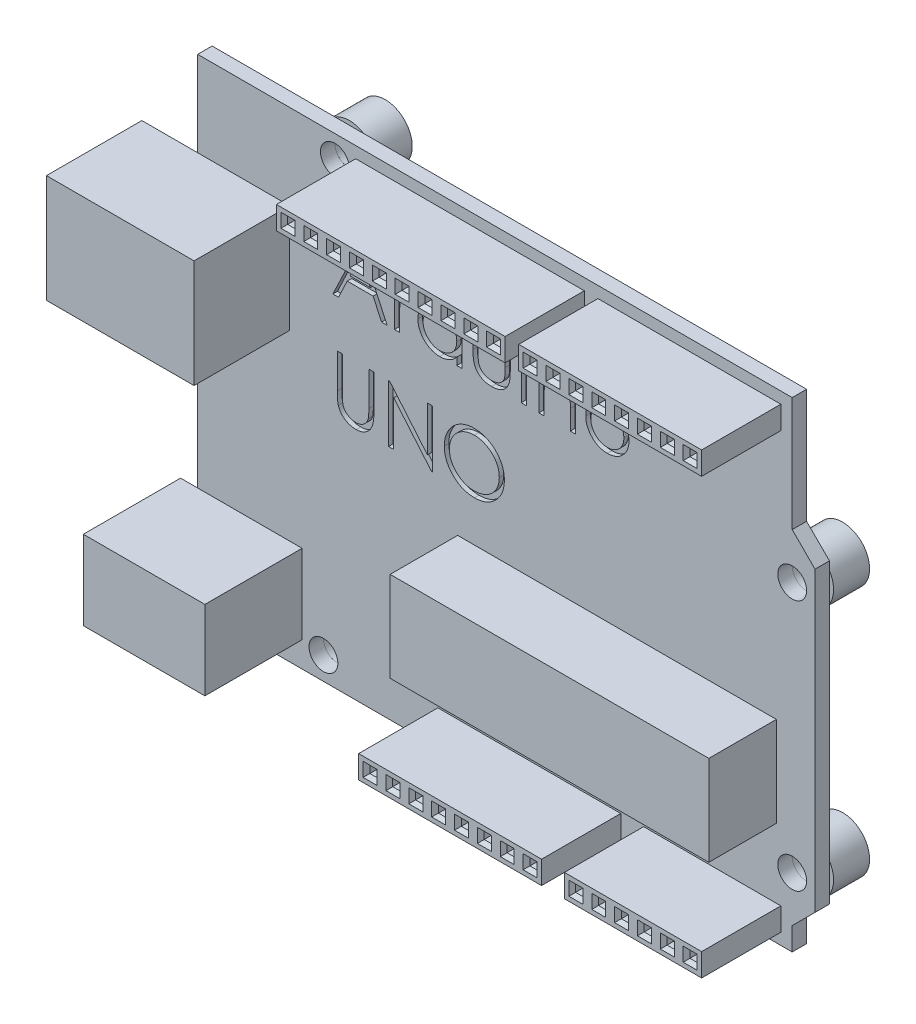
SolidWorks part; units mm, degrees
ref_plane "Front" through (0, 0, 0) normal (0, 0, 1) x (1, 0, 0)
ref_plane "Top" through (0, 0, 0) normal (0, 1, 0) x (1, 0, 0)
ref_plane "Right" through (0, 0, 0) normal (1, 0, 0) x (0, 0, -1)
sketch "Esquisse2" plane through (0, 0, 0) normal (0, 0, 1) x (1, 0, 0)
  line L0 (0, 0) -> (66.04, 0)
  line L1 (66.04, 0) -> (66.04, 2.54)
  line L2 (66.04, 2.54) -> (68.58, 5.08)
  line L3 (68.58, 5.08) -> (68.58, 38.1)
  line L4 (68.58, 38.1) -> (66.04, 40.64)
  line L5 (66.04, 40.64) -> (66.04, 53.34)
  line L6 (66.04, 53.34) -> (0, 53.34)
  line L7 (0, 53.34) -> (0, 0)
  circle A0 centre (15.24, 50.8) radius 1.6
  circle A1 centre (13.97, 2.54) radius 1.6
  circle A2 centre (66.04, 7.62) radius 1.6
  circle A3 centre (66.04, 35.56) radius 1.6
  dimension "D7" = 3.2
  dimension "D9" = 2.54
  dimension "D10" = 15.24
  dimension "D12" = 5.08
  dimension "D13" = 15.24
  dimension "D3" = 50.8
  dimension "D8" = 27.94
  dimension "D1" = 53.34
  dimension "D2" = 68.58
  dimension "D4" = 2.54
  dimension "D5" = 33.02
  dimension "D6" = 2.54
  dimension "D11" = 13.97
extrude "Boss.-Extru.1" add sketch "Esquisse2" along normal blind 1.6
sketch "Esquisse3" plane through (0, 0, 1.6) normal (0, 0, 1) x (1, 0, 0)
  line L0 (17.55, 50.8) -> (64.78, 50.8) construction
  line L1 (17.55, 52.07) -> (64.78, 52.07)
  line L2 (17.55, 52.07) -> (17.55, 49.53)
  line L3 (17.55, 49.53) -> (64.78, 49.53)
  line L4 (64.78, 52.07) -> (64.78, 49.53)
  line L5 (66.04, 53.34) -> (0, 53.34) construction
  line L6 (0, 53.34) -> (0, 0) construction
  line L7 (63.11, 51.2) -> (63.91, 51.2)
  line L8 (63.11, 51.2) -> (63.11, 50.4)
  line L9 (63.11, 50.4) -> (63.91, 50.4)
  line L10 (63.91, 51.2) -> (63.91, 50.4)
  line L11 (63.11, 51.2) -> (63.91, 50.4) construction
  line L12 (63.11, 50.4) -> (63.91, 51.2) construction
  line L13 (60.57, 51.2) -> (61.37, 51.2)
  line L14 (60.57, 51.2) -> (60.57, 50.4)
  line L15 (60.57, 50.4) -> (61.37, 50.4)
  line L16 (61.37, 51.2) -> (61.37, 50.4)
  line L17 (58.03, 51.2) -> (58.83, 51.2)
  line L18 (58.03, 51.2) -> (58.03, 50.4)
  line L19 (58.03, 50.4) -> (58.83, 50.4)
  line L20 (58.83, 51.2) -> (58.83, 50.4)
  line L21 (55.49, 51.2) -> (56.29, 51.2)
  line L22 (55.49, 51.2) -> (55.49, 50.4)
  line L23 (55.49, 50.4) -> (56.29, 50.4)
  line L24 (56.29, 51.2) -> (56.29, 50.4)
  line L25 (52.95, 51.2) -> (53.75, 51.2)
  line L26 (52.95, 51.2) -> (52.95, 50.4)
  line L27 (52.95, 50.4) -> (53.75, 50.4)
  line L28 (53.75, 51.2) -> (53.75, 50.4)
  line L29 (50.41, 51.2) -> (51.21, 51.2)
  line L30 (50.41, 51.2) -> (50.41, 50.4)
  line L31 (50.41, 50.4) -> (51.21, 50.4)
  line L32 (51.21, 51.2) -> (51.21, 50.4)
  line L33 (47.87, 51.2) -> (48.67, 51.2)
  line L34 (47.87, 51.2) -> (47.87, 50.4)
  line L35 (47.87, 50.4) -> (48.67, 50.4)
  line L36 (48.67, 51.2) -> (48.67, 50.4)
  line L37 (45.33, 51.2) -> (46.13, 51.2)
  line L38 (45.33, 51.2) -> (45.33, 50.4)
  line L39 (45.33, 50.4) -> (46.13, 50.4)
  line L40 (46.13, 51.2) -> (46.13, 50.4)
  line L41 (63.11, 51.2) -> (60.57, 51.2) construction
  line L42 (41.28, 51.2) -> (42.08, 51.2)
  line L43 (41.28, 51.2) -> (41.28, 50.4)
  line L44 (41.28, 50.4) -> (42.08, 50.4)
  line L45 (42.08, 51.2) -> (42.08, 50.4)
  line L46 (45.33, 51.2) -> (41.28, 51.2) construction
  line L47 (38.74, 51.2) -> (39.54, 51.2)
  line L48 (38.74, 51.2) -> (38.74, 50.4)
  line L49 (38.74, 50.4) -> (39.54, 50.4)
  line L50 (39.54, 51.2) -> (39.54, 50.4)
  line L51 (36.2, 51.2) -> (37, 51.2)
  line L52 (36.2, 51.2) -> (36.2, 50.4)
  line L53 (36.2, 50.4) -> (37, 50.4)
  line L54 (37, 51.2) -> (37, 50.4)
  line L55 (33.66, 51.2) -> (34.46, 51.2)
  line L56 (33.66, 51.2) -> (33.66, 50.4)
  line L57 (33.66, 50.4) -> (34.46, 50.4)
  line L58 (34.46, 51.2) -> (34.46, 50.4)
  line L59 (31.12, 51.2) -> (31.92, 51.2)
  line L60 (31.12, 51.2) -> (31.12, 50.4)
  line L61 (31.12, 50.4) -> (31.92, 50.4)
  line L62 (31.92, 51.2) -> (31.92, 50.4)
  line L63 (28.58, 51.2) -> (29.38, 51.2)
  line L64 (28.58, 51.2) -> (28.58, 50.4)
  line L65 (28.58, 50.4) -> (29.38, 50.4)
  line L66 (29.38, 51.2) -> (29.38, 50.4)
  line L67 (26.04, 51.2) -> (26.84, 51.2)
  line L68 (26.04, 51.2) -> (26.04, 50.4)
  line L69 (26.04, 50.4) -> (26.84, 50.4)
  line L70 (26.84, 51.2) -> (26.84, 50.4)
  line L71 (23.5, 51.2) -> (24.3, 51.2)
  line L72 (23.5, 51.2) -> (23.5, 50.4)
  line L73 (23.5, 50.4) -> (24.3, 50.4)
  line L74 (24.3, 51.2) -> (24.3, 50.4)
  line L75 (20.96, 51.2) -> (21.76, 51.2)
  line L76 (20.96, 51.2) -> (20.96, 50.4)
  line L77 (20.96, 50.4) -> (21.76, 50.4)
  line L78 (21.76, 51.2) -> (21.76, 50.4)
  line L79 (18.42, 51.2) -> (19.22, 51.2)
  line L80 (18.42, 51.2) -> (18.42, 50.4)
  line L81 (18.42, 50.4) -> (19.22, 50.4)
  line L82 (19.22, 51.2) -> (19.22, 50.4)
  line L83 (41.28, 51.2) -> (38.74, 51.2) construction
  line L84 (18.82, 51.2) -> (18.82, 50.4) construction
  line L85 (26.68, 2.54) -> (64.78, 2.54) construction
  line L86 (26.68, 3.81) -> (64.78, 3.81)
  line L87 (26.68, 3.81) -> (26.68, 1.27)
  line L88 (26.68, 1.27) -> (64.78, 1.27)
  line L89 (64.78, 3.81) -> (64.78, 1.27)
  line L90 (0, 0) -> (66.04, 0) construction
  line L91 (30.09, 2.94) -> (30.89, 2.94)
  line L92 (27.55, 2.94) -> (28.35, 2.94)
  line L93 (27.55, 2.94) -> (27.55, 2.14)
  line L94 (27.55, 2.14) -> (28.35, 2.14)
  line L95 (28.35, 2.94) -> (28.35, 2.14)
  line L96 (27.55, 2.94) -> (28.35, 2.14) construction
  line L97 (27.55, 2.14) -> (28.35, 2.94) construction
  line L98 (30.09, 2.94) -> (30.09, 2.14)
  line L99 (30.09, 2.14) -> (30.89, 2.14)
  line L100 (30.89, 2.94) -> (30.89, 2.14)
  line L101 (30.09, 2.94) -> (30.89, 2.14) construction
  line L102 (30.09, 2.14) -> (30.89, 2.94) construction
  line L103 (32.63, 2.94) -> (33.43, 2.94)
  line L104 (32.63, 2.94) -> (32.63, 2.14)
  line L105 (32.63, 2.14) -> (33.43, 2.14)
  line L106 (33.43, 2.94) -> (33.43, 2.14)
  line L107 (32.63, 2.94) -> (33.43, 2.14) construction
  line L108 (32.63, 2.14) -> (33.43, 2.94) construction
  line L109 (35.17, 2.94) -> (35.97, 2.94)
  line L110 (35.17, 2.94) -> (35.17, 2.14)
  line L111 (35.17, 2.14) -> (35.97, 2.14)
  line L112 (35.97, 2.94) -> (35.97, 2.14)
  line L113 (35.17, 2.94) -> (35.97, 2.14) construction
  line L114 (35.17, 2.14) -> (35.97, 2.94) construction
  line L115 (37.71, 2.94) -> (38.51, 2.94)
  line L116 (37.71, 2.94) -> (37.71, 2.14)
  line L117 (37.71, 2.14) -> (38.51, 2.14)
  line L118 (38.51, 2.94) -> (38.51, 2.14)
  line L119 (37.71, 2.94) -> (38.51, 2.14) construction
  line L120 (37.71, 2.14) -> (38.51, 2.94) construction
  line L121 (40.25, 2.94) -> (41.05, 2.94)
  line L122 (40.25, 2.94) -> (40.25, 2.14)
  line L123 (40.25, 2.14) -> (41.05, 2.14)
  line L124 (41.05, 2.94) -> (41.05, 2.14)
  line L125 (40.25, 2.94) -> (41.05, 2.14) construction
  line L126 (40.25, 2.14) -> (41.05, 2.94) construction
  line L127 (42.79, 2.94) -> (43.59, 2.94)
  line L128 (42.79, 2.94) -> (42.79, 2.14)
  line L129 (42.79, 2.14) -> (43.59, 2.14)
  line L130 (43.59, 2.94) -> (43.59, 2.14)
  line L131 (42.79, 2.94) -> (43.59, 2.14) construction
  line L132 (42.79, 2.14) -> (43.59, 2.94) construction
  line L133 (45.33, 2.94) -> (46.13, 2.94)
  line L134 (45.33, 2.94) -> (45.33, 2.14)
  line L135 (45.33, 2.14) -> (46.13, 2.14)
  line L136 (46.13, 2.94) -> (46.13, 2.14)
  line L137 (45.33, 2.94) -> (46.13, 2.14) construction
  line L138 (45.33, 2.14) -> (46.13, 2.94) construction
  line L139 (27.95, 2.54) -> (30.49, 2.54) construction
  line L140 (50.41, 2.94) -> (51.21, 2.94)
  line L141 (50.41, 2.94) -> (50.41, 2.14)
  line L142 (50.41, 2.14) -> (51.21, 2.14)
  line L143 (51.21, 2.94) -> (51.21, 2.14)
  line L144 (50.41, 2.94) -> (51.21, 2.14) construction
  line L145 (50.41, 2.14) -> (51.21, 2.94) construction
  line L146 (45.73, 2.54) -> (50.81, 2.54) construction
  line L147 (52.95, 2.94) -> (53.75, 2.94)
  line L148 (52.95, 2.94) -> (52.95, 2.14)
  line L149 (52.95, 2.14) -> (53.75, 2.14)
  line L150 (53.75, 2.94) -> (53.75, 2.14)
  line L151 (52.95, 2.94) -> (53.75, 2.14) construction
  line L152 (52.95, 2.14) -> (53.75, 2.94) construction
  line L153 (55.49, 2.94) -> (56.29, 2.94)
  line L154 (55.49, 2.94) -> (55.49, 2.14)
  line L155 (55.49, 2.14) -> (56.29, 2.14)
  line L156 (56.29, 2.94) -> (56.29, 2.14)
  line L157 (55.49, 2.94) -> (56.29, 2.14) construction
  line L158 (55.49, 2.14) -> (56.29, 2.94) construction
  line L159 (58.03, 2.94) -> (58.83, 2.94)
  line L160 (58.03, 2.94) -> (58.03, 2.14)
  line L161 (58.03, 2.14) -> (58.83, 2.14)
  line L162 (58.83, 2.94) -> (58.83, 2.14)
  line L163 (58.03, 2.94) -> (58.83, 2.14) construction
  line L164 (58.03, 2.14) -> (58.83, 2.94) construction
  line L165 (60.57, 2.94) -> (61.37, 2.94)
  line L166 (60.57, 2.94) -> (60.57, 2.14)
  line L167 (60.57, 2.14) -> (61.37, 2.14)
  line L168 (61.37, 2.94) -> (61.37, 2.14)
  line L169 (60.57, 2.94) -> (61.37, 2.14) construction
  line L170 (60.57, 2.14) -> (61.37, 2.94) construction
  line L171 (63.11, 2.94) -> (63.91, 2.94)
  line L172 (63.11, 2.94) -> (63.11, 2.14)
  line L173 (63.11, 2.14) -> (63.91, 2.14)
  line L174 (63.91, 2.94) -> (63.91, 2.14)
  line L175 (63.11, 2.94) -> (63.91, 2.14) construction
  line L176 (63.11, 2.14) -> (63.91, 2.94) construction
  line L177 (50.81, 2.54) -> (53.35, 2.54) construction
  point P8 (63.51, 50.8)
  point P99 (27.95, 2.54)
  point P105 (30.49, 2.54)
  point P110 (33.03, 2.54)
  point P115 (35.57, 2.54)
  point P120 (38.11, 2.54)
  point P125 (40.65, 2.54)
  point P130 (43.19, 2.54)
  point P135 (45.73, 2.54)
  point P143 (50.81, 2.54)
  point P150 (53.35, 2.54)
  point P155 (55.89, 2.54)
  point P160 (58.43, 2.54)
  point P165 (60.97, 2.54)
  point P170 (63.51, 2.54)
  dimension "D1" = 2.54
  dimension "D2" = 0.8
  dimension "D3" = 63.51
  dimension "D5" = 2.54
  dimension "D7" = 4.05
  dimension "D9" = 2.54
  dimension "D10" = 2.54
  dimension "D11" = 1.27
  dimension "D12" = 1.27
  dimension "D13" = 2.54
  dimension "D14" = 2.54
  dimension "D15" = 27.95
  dimension "D16" = 1.27
  dimension "D17" = 0.8
  dimension "D19" = 2.54
  dimension "D21" = 5.08
  dimension "D23" = 2.54
  dimension "D24" = 1.27
  dimension "D4" = 8
  dimension "D6" = 2
  dimension "D8" = 10
  dimension "D18" = 8
  dimension "D20" = 2
  dimension "D22" = 6
extrude "Boss.-Extru.2" add sketch "Esquisse3" along normal blind 8.8
chamfer "Chanfrein2" distance 0.375 angle 45 128 edges at (63.51, 50.4, 10.4) (63.11, 50.8, 10.4) (63.51, 51.2, 10.4) (63.91, 50.8, 10.4) (39.14, 50.4, 10.4) (38.74, 50.8, 10.4) (39.14, 51.2, 10.4) (39.54, 50.8, 10.4) (60.97, 50.4, 10.4) (60.57, 50.8, 10.4) (60.97, 51.2, 10.4) (61.37, 50.8, 10.4) (58.43, 50.4, 10.4) (58.03, 50.8, 10.4) (58.43, 51.2, 10.4) (58.83, 50.8, 10.4) (55.89, 50.4, 10.4) (55.49, 50.8, 10.4) (55.89, 51.2, 10.4) (56.29, 50.8, 10.4) (53.35, 50.4, 10.4) (52.95, 50.8, 10.4) (53.35, 51.2, 10.4) (53.75, 50.8, 10.4) (50.81, 50.4, 10.4) (50.41, 50.8, 10.4) (50.81, 51.2, 10.4) (51.21, 50.8, 10.4) (48.27, 50.4, 10.4) (47.87, 50.8, 10.4) (48.27, 51.2, 10.4) (48.67, 50.8, 10.4) (45.73, 50.4, 10.4) (45.33, 50.8, 10.4) (45.73, 51.2, 10.4) (46.13, 50.8, 10.4) (41.68, 50.4, 10.4) (41.28, 50.8, 10.4) (41.68, 51.2, 10.4) (42.08, 50.8, 10.4) (36.6, 50.4, 10.4) (36.2, 50.8, 10.4) (36.6, 51.2, 10.4) (37, 50.8, 10.4) (34.06, 50.4, 10.4) (33.66, 50.8, 10.4) (34.06, 51.2, 10.4) (34.46, 50.8, 10.4) (31.52, 50.4, 10.4) (31.12, 50.8, 10.4) (31.52, 51.2, 10.4) (31.92, 50.8, 10.4) (28.98, 50.4, 10.4) (28.58, 50.8, 10.4) (28.98, 51.2, 10.4) (29.38, 50.8, 10.4) (26.44, 50.4, 10.4) (26.04, 50.8, 10.4) (26.44, 51.2, 10.4) (26.84, 50.8, 10.4) (23.9, 50.4, 10.4) (23.5, 50.8, 10.4) (23.9, 51.2, 10.4) (24.3, 50.8, 10.4) (21.36, 50.4, 10.4) (20.96, 50.8, 10.4) (21.36, 51.2, 10.4) (21.76, 50.8, 10.4) (18.82, 50.4, 10.4) (18.42, 50.8, 10.4) (18.82, 51.2, 10.4) (19.22, 50.8, 10.4) (27.95, 2.14, 10.4) (27.55, 2.54, 10.4) (27.95, 2.94, 10.4) (28.35, 2.54, 10.4) (30.49, 2.14, 10.4) (30.09, 2.54, 10.4) (30.49, 2.94, 10.4) (30.89, 2.54, 10.4) (33.03, 2.14, 10.4) (32.63, 2.54, 10.4) (33.03, 2.94, 10.4) (33.43, 2.54, 10.4) (35.57, 2.14, 10.4) (35.17, 2.54, 10.4) (35.57, 2.94, 10.4) (35.97, 2.54, 10.4) (38.11, 2.14, 10.4) (37.71, 2.54, 10.4) (38.11, 2.94, 10.4) (38.51, 2.54, 10.4) (40.65, 2.14, 10.4) (40.25, 2.54, 10.4) (40.65, 2.94, 10.4) (41.05, 2.54, 10.4) (43.19, 2.14, 10.4) (42.79, 2.54, 10.4) (43.19, 2.94, 10.4) (43.59, 2.54, 10.4) (45.73, 2.14, 10.4) (45.33, 2.54, 10.4) (45.73, 2.94, 10.4) (46.13, 2.54, 10.4) (50.81, 2.14, 10.4) (50.41, 2.54, 10.4) (50.81, 2.94, 10.4) (51.21, 2.54, 10.4) (53.35, 2.14, 10.4) (52.95, 2.54, 10.4) (53.35, 2.94, 10.4) (53.75, 2.54, 10.4) (55.89, 2.14, 10.4) (55.49, 2.54, 10.4) (55.89, 2.94, 10.4) (56.29, 2.54, 10.4) (58.43, 2.14, 10.4) (58.03, 2.54, 10.4) (58.43, 2.94, 10.4) (58.83, 2.54, 10.4) (60.97, 2.14, 10.4) (60.57, 2.54, 10.4) (60.97, 2.94, 10.4) (61.37, 2.54, 10.4) (63.51, 2.14, 10.4) (63.11, 2.54, 10.4) (63.51, 2.94, 10.4) (63.91, 2.54, 10.4)
sketch "Esquisse4" plane through (0, 0, 1.6) normal (0, 0, 1) x (1, 0, 0)
  line L0 (0, 0) -> (66.04, 0) construction
  line L1 (28.88, 21.5) -> (64.28, 21.5)
  line L2 (28.88, 21.5) -> (28.88, 11.5)
  line L3 (28.88, 11.5) -> (64.28, 11.5)
  line L4 (64.28, 21.5) -> (64.28, 11.5)
  line L5 (28.88, 21.5) -> (64.28, 11.5) construction
  line L6 (28.88, 11.5) -> (64.28, 21.5) construction
  line L7 (68.58, 5.08) -> (68.58, 38.1) construction
  point P0 (46.58, 16.5)
  dimension "D1" = 11.5
  dimension "D2" = 35.4
  dimension "D3" = 4.3
  dimension "D4" = 10
extrude "Boss.-Extru.3" add sketch "Esquisse4" along normal blind 7.5
sketch "Esquisse5" plane through (0, 0, 1.6) normal (0, 0, 1) x (1, 0, 0)
  line L0 (-6.2, 37.87) -> (10.2, 37.87) construction
  line L1 (-6.2, 43.87) -> (10.2, 43.87)
  line L2 (-6.2, 43.87) -> (-6.2, 31.87)
  line L3 (-6.2, 31.87) -> (10.2, 31.87)
  line L4 (10.2, 43.87) -> (10.2, 31.87)
  line L5 (0, 0) -> (66.04, 0) construction
  line L6 (0, 53.34) -> (0, 0) construction
  dimension "D1" = 37.87
  dimension "D2" = 12
  dimension "D3" = 16.4
  dimension "D4" = 6.2
extrude "Boss.-Extru.4" add sketch "Esquisse5" along normal blind 10.6
sketch "Esquisse6" plane through (0, 0, 1.6) normal (0, 0, 1) x (1, 0, 0)
  line L0 (-1.9, 7.22) -> (11.6, 7.22) construction
  line L1 (-1.9, 11.62) -> (11.6, 11.62)
  line L2 (-1.9, 11.62) -> (-1.9, 2.82)
  line L3 (-1.9, 2.82) -> (11.6, 2.82)
  line L4 (11.6, 11.62) -> (11.6, 2.82)
  line L5 (0, 0) -> (66.04, 0) construction
  line L6 (0, 31.87) -> (0, 0) construction
  dimension "D1" = 7.22
  dimension "D2" = 13.5
  dimension "D3" = 8.8
  dimension "D4" = 1.9
extrude "Boss.-Extru.5" add sketch "Esquisse6" along normal blind 10.8 separate body
sketch "Esquisse7" plane through (0, 0, 10.4) normal (0, 0, 1) x (1, 0, 0)
  line L0 (64.78, 3.81) -> (26.68, 3.81) construction
  line L1 (47, 3.81) -> (49.54, 3.81)
  line L2 (47, 3.81) -> (47, 1.27)
  line L3 (47, 1.27) -> (49.54, 1.27)
  line L4 (49.54, 3.81) -> (49.54, 1.27)
  line L5 (26.68, 1.27) -> (64.78, 1.27) construction
  line L6 (45.73, 2.94) -> (45.73, 2.14) construction
  line L7 (46.13, 2.94) -> (45.33, 2.94) construction
  line L8 (45.33, 2.14) -> (46.13, 2.14) construction
  line L9 (50.81, 2.94) -> (50.81, 2.14) construction
  line L10 (51.21, 2.94) -> (50.41, 2.94) construction
  line L11 (50.41, 2.14) -> (51.21, 2.14) construction
  line L12 (64.78, 52.07) -> (17.55, 52.07) construction
  line L13 (42.95, 52.07) -> (44.46, 52.07)
  line L14 (42.95, 52.07) -> (42.95, 49.53)
  line L15 (42.95, 49.53) -> (44.46, 49.53)
  line L16 (44.46, 52.07) -> (44.46, 49.53)
  line L17 (17.55, 49.53) -> (64.78, 49.53) construction
  line L18 (41.68, 51.2) -> (41.68, 50.4) construction
  line L19 (42.08, 51.2) -> (41.28, 51.2) construction
  line L20 (41.28, 50.4) -> (42.08, 50.4) construction
  line L21 (45.73, 51.2) -> (45.73, 50.4) construction
  line L22 (46.13, 51.2) -> (45.33, 51.2) construction
  line L23 (45.33, 50.4) -> (46.13, 50.4) construction
  dimension "D1" = 1.27
  dimension "D2" = 1.27
  dimension "D3" = 1.27
  dimension "D4" = 1.27
extrude "Enlèv. mat.-Extru.1" cut sketch "Esquisse7" against normal up to surface (8.8 mm away)
sketch "Esquisse8" plane through (0, 0, 0) normal (0, 0, -1) x (-1, 0, 0)
  circle A0 centre (-66.04, 35.56) radius 1.6
  circle A1 centre (-66.04, 35.56) radius 3
  circle A2 centre (-66.04, 7.62) radius 3
  circle A3 centre (-66.04, 7.62) radius 1.6
  circle A4 centre (-15.24, 50.8) radius 3
  circle A5 centre (-15.24, 50.8) radius 1.6
  circle A6 centre (-13.97, 2.54) radius 3
  circle A7 centre (-13.97, 2.54) radius 1.6
  dimension "D1" = 3.2
  dimension "D2" = 6
extrude "Boss.-Extru.6" add sketch "Esquisse8" along normal blind 4 separate body
sketch "Esquisse9" plane through (0, 0, 1.6) normal (0, 0, 1) x (1, 0, 0)
  line L0 (14.6956, 37.7929) -> (60.1475, 37.7929) construction
  text T0 "Arduino   UNO"
extrude "Enlèv. mat.-Extru.2" cut sketch "Esquisse9" against normal blind 0.5
